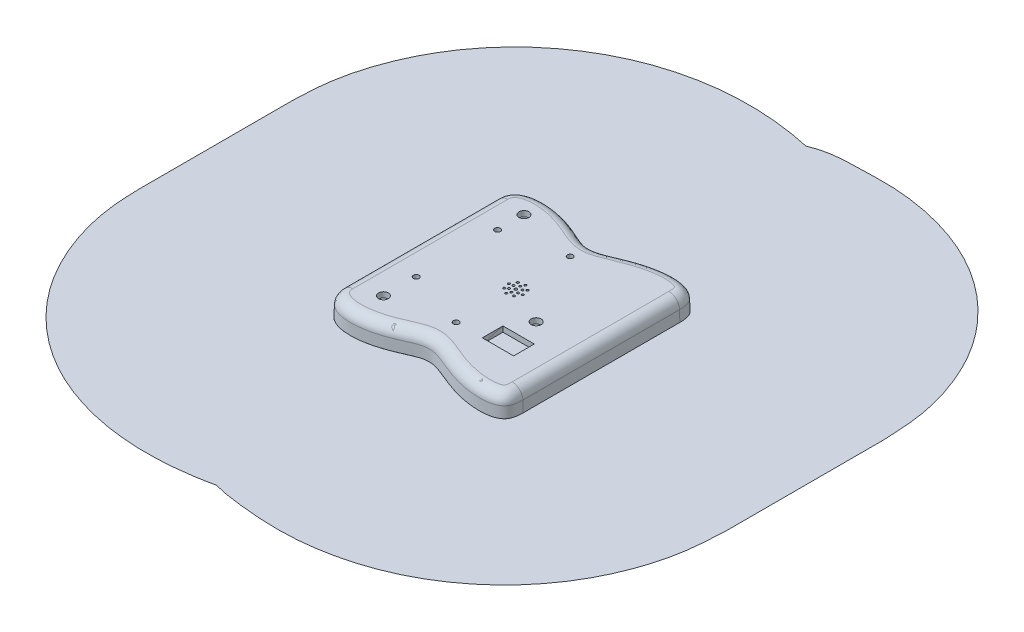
SolidWorks part; units mm, degrees
ref_plane "Front Plane" through (0, 0, 0) normal (0, 0, 1) x (1, 0, 0)
ref_plane "Top Plane" through (0, 0, 0) normal (0, 1, 0) x (1, 0, 0)
ref_plane "Right Plane" through (0, 0, 0) normal (1, 0, 0) x (0, 0, -1)
imported_body "Stock-part2-1"
scale "Scale1" scale about centroid uniform scaling yes scale factor 1.05
other "Parting Line1"
other "Shut-Off Surface1"
other "Parting Surface2" parameters "D1"=100
ref_plane "Plane1" through (0, 10, 0) normal (0, 1, 0) x (1, 0, 0)
sketch "Sketch1" plane through (0, 10, 0) normal (0, 1, 0) x (1, 0, 0)
  line L1 (-42.1315, 120.2314) -> (130.1637, 120.2314)
  line L2 (-42.1315, 120.2314) -> (-42.1315, -34.0327)
  line L3 (-42.1315, -34.0327) -> (130.1637, -34.0327)
  line L4 (130.1637, 120.2314) -> (130.1637, -34.0327)
  line L5 (-42.1315, 120.2314) -> (130.1637, -34.0327) construction
  line L6 (-42.1315, -34.0327) -> (130.1637, 120.2314) construction
  circle A0 centre (44.0161, 42.3953) radius 0.704 construction
  point P0 (44.0161, 43.0994)
